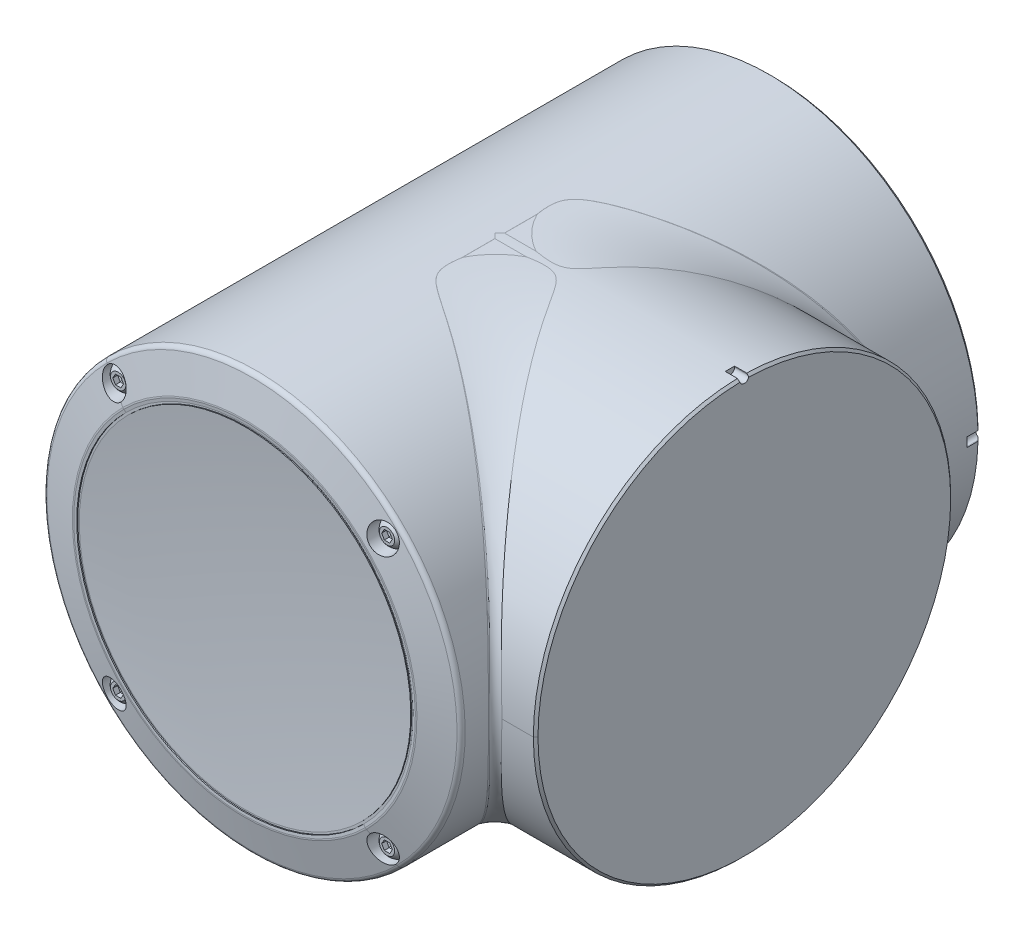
SolidWorks part; units mm, degrees
other "<4.0.07.2008582>-<输入1>"
other "<4.0.07.2008582>-<输入1>"
other "<4.0.07.2008582>-<输入1>"
other "<4.0.07.2008582>-<输入1>"
ref_plane "前视基准面" through (0, 0, 0) normal (0, 0, 1) x (1, 0, 0)
ref_plane "上视基准面" through (0, 0, 0) normal (0, 1, 0) x (1, 0, 0)
ref_plane "右视基准面" through (0, 0, 0) normal (1, 0, 0) x (0, 0, -1)
imported_body "输入1"
imported_body "输入2"
other "删除面1"
inserted part "4.0.07.2008582"
move or copy body "实体-移动/复制2" placed by mates yes
inserted part "4.0.07.20085822"
move or copy body "实体-移动/复制4" placed by mates yes
inserted part "4.0.07.20085823"
move or copy body "实体-移动/复制6" placed by mates yes
inserted part "4.0.07.20085824"
move or copy body "实体-移动/复制8" placed by mates yes
other "删除面2"
combine bodies "组合1" operation type add bodies to combine 113 114 115 116 117 118
